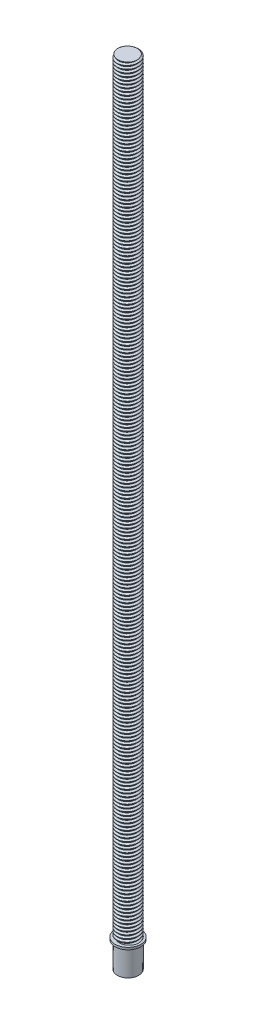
SolidWorks part; units mm, degrees
ref_plane "Front Plane" through (0, 0, 0) normal (0, 0, 1) x (1, 0, 0)
ref_plane "Top Plane" through (0, 0, 0) normal (0, 1, 0) x (1, 0, 0)
ref_plane "Right Plane" through (0, 0, 0) normal (1, 0, 0) x (0, 0, -1)
sketch "Sketch1" plane through (0, 0, 0) normal (0, 1, 0) x (1, 0, 0)
  circle A0 centre (0, 0) radius 5
  dimension "D1" = 10
extrude "Boss-Extrude1" add sketch "Sketch1" along normal blind 355.6
thread "Thread1" pitch 1.5 start angle 0, offset 1.5, length 361.95, pitch 1.5, diameter 10
ref_plane "Plane1" through (-5, 357.1, 0) normal (0, 0, 1) x (-1, 0, 0)
sketch "Thread Profile1" plane through (-5, 357.1, 0) normal (0, 0, 1) x (-1, 0, 0)
  line L0 (0, 0) -> (0, 1.5) construction
  line L11 (0, 0) -> (0, 1.3125)
  line L12 (0, 1.3125) -> (-0.8119, 0.8437)
  line L13 (-0.8119, 0.8437) -> (-0.8119, 0.4687)
  line L15 (-0.8119, 0.4687) -> (0, 0)
  line L17 (-0.8119, 0.6562) -> (0, 0.6562) construction
  point P2 (0, 0)
  dimension "Pitch" = 1.5
  dimension "Profile_Angle" = 60
  dimension "Profile_Land" = 0.375
  dimension "Profile_Height" = 0.8119
sketch "Sketch6" plane through (0, 0, 0) normal (0, -1, 0) x (1, 0, 0)
  circle A0 centre (0, 0) radius 5
  dimension "D1" = 10
extrude "Boss-Extrude2" add sketch "Sketch6" along normal blind 12
sketch "Sketch8" plane through (0, 0, 0) normal (0, 1, 0) x (1, 0, 0)
  circle A0 centre (0, 0) radius 6
  dimension "D1" = 12
extrude "Boss-Extrude3" add sketch "Sketch8" along normal blind 1
